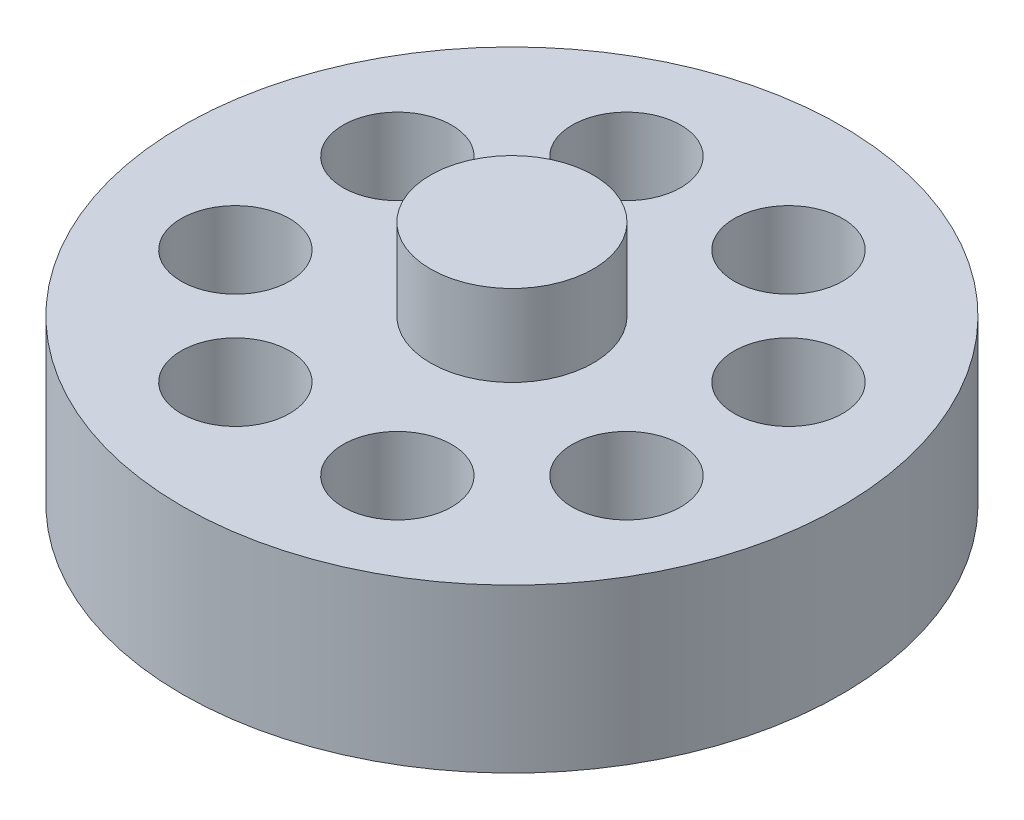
SolidWorks part; units mm, degrees
ref_plane "Plane1" through (0, 0, 0) normal (0, 0, 1) x (1, 0, 0)
ref_plane "Plane2" through (0, 0, 0) normal (0, 1, 0) x (1, 0, 0)
ref_plane "Plane3" through (0, 0, 0) normal (1, 0, 0) x (0, 0, -1)
sketch "Sketch1" plane through (0, 0, 0) normal (0, 1, 0) x (1, 0, 0)
  circle A0 centre (0, 0) radius 60.725
  dimension "D1" = 121.45
extrude "Extrude1" add sketch "Sketch1" along normal mid plane 30
sketch "Sketch2" plane through (0, 0, 0) normal (0, 1, 0) x (1, 0, 0)
  circle A0 centre (0, 0) radius 15
  dimension "D1" = 30
sketch "Sketch3" plane through (0, 0, 0) normal (0, 1, 0) x (1, 0, 0)
  line L0 (-74.7326, 0) -> (90.6654, 0) construction
  line L1 (28.8022, -69.5346) -> (-28.4538, 68.6934) construction
  circle A0 centre (0, 0) radius 39 construction
  circle A1 centre (-14.9247, 36.0313) radius 10
  dimension "D1" = 78
  dimension "D2" = 20
  dimension "D3" = 67.5
extrude "Cut-Extrude2" cut sketch "Sketch3" against normal through all and the other way through all
extrude "Extrude2" add sketch "Sketch2" along normal blind 30 and the other way blind 30
fillet " round 1" [suppressed] radius 2
fillet "round 2" [suppressed] radius 2
pattern_circular "CirPattern1" count 8 over 360 about axis through (0, 0, 0) along (0, 1, 0) of "Cut-Extrude2", "round 2"
